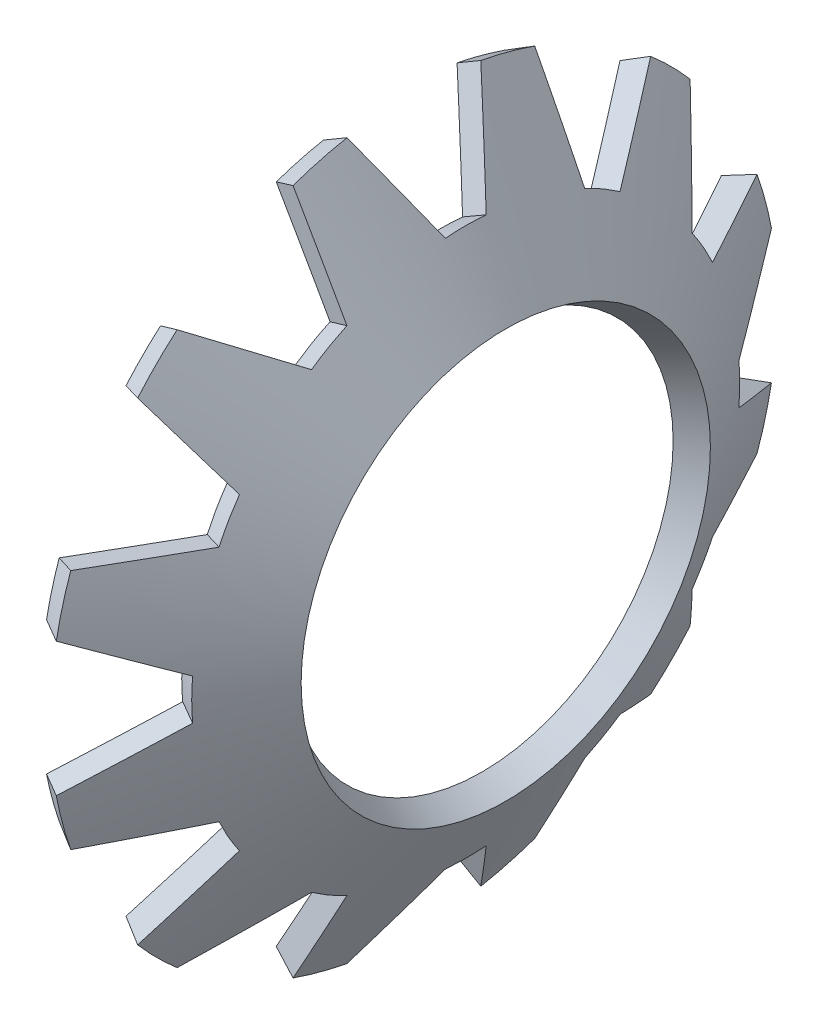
SolidWorks part; units mm, degrees
ref_plane "Plane1" through (0, 0, 0) normal (0, 0, 1) x (1, 0, 0)
ref_plane "Plane2" through (0, 0, 0) normal (0, 1, 0) x (1, 0, 0)
ref_plane "Plane3" through (0, 0, 0) normal (1, 0, 0) x (0, 0, -1)
revolve "Base-Revolve" add sketch "SecSke" angle 360 about L0
sketch "SecSke" plane through (0, 0, 0) normal (0, 0, 1) x (1, 0, 0)
  line L0 (-34.925, 0) -> (9.525, 0) construction
  line L1 (-2.5981, 4.5) -> (-4.6188, 8)
  line L3 (-5.1384, 7.7) -> (-3.1177, 4.2)
  line L4 (-3.1177, 4.2) -> (-2.5981, 4.5)
  line L5 (-5.1384, 7.7) -> (-4.6188, 8)
  dimension "D1" = 60
  dimension "D2" = 4.0415
  dimension "Thickness" = 0.6
  dimension "Inside_dia" = 8.4
  dimension "Outside_dia" = 16
pattern_circular "ExtCuts" count 12 over 360 about axis through (0, 0, 0) along (1, 0, 0)
extrude "ExtCut" cut sketch "ExtCutSke" against normal through all
sketch "ExtCutSke" plane through (-4.6188, 8, 0) normal (0.866, 0.5, 0) x (0, 0, 1)
  line L1 (0, -8.2249) -> (0, 14.0001) construction
  line L2 (0, 0) -> (0, 8) construction
  line L3 (-0.4488, 2.2976) -> (-1.6388, -0.2386)
  line L4 (0.4488, 2.2976) -> (1.6388, -0.2386)
  arc A0 (-0.4488, 2.2976) -> (0.4488, 2.2976) centre (0, 8) ccw
  arc A1 (-1.6388, -0.2386) -> (1.6388, -0.2386) centre (0, 8) ccw
  ellipse E1 centre (0, 6.9282) end of major axis (-8, 6.9282) minor radius 6.9282 construction
  dimension "Clr_dia" = 16.8
  dimension "Cut_dia" = 11.44
  dimension "Cone_side" = 8
  dimension "Cut_ang" = 9
  dimension "Clr_ang" = 22.5
ref_plane "CutPln" through (-4.6188, 8, 0) normal (0.866, 0.5, 0) x (0, 0, 1)
equation "' \"Inside_dia@SecSke\" = 8.4"
equation "' \"Outside_dia@SecSke\" = 16"
equation "' \"Thickness@SecSke\" = 0.6"
equation "' \"Count@ExtCuts\" = 12"
equation "' \"Inside_dia@SecSke\" = 3.2"
equation "' \"Outside_dia@SecSke\" = 6"
equation "' \"Thickness@SecSke\" = 0.4"
equation "' \"Count@ExtCuts\" = 8"
equation " \"Cone_side@ExtCutSke\" = \"Outside_dia@SecSke\" / 2.0"
equation " \"Angle@ExtCuts\" = 360 / \"Count@ExtCuts\""
equation " \"Clr_dia@ExtCutSke\" =  \"Outside_dia@SecSke\" * 1.05"
equation " \"Cut_dia@ExtCutSke\" = \"Outside_dia@SecSke\" - (\"Outside_dia@SecSke\"  - \"Inside_dia@SecSke\" ) * 0.6"
equation " \"Clr_ang@ExtCutSke\" = (360 / \"Count@ExtCuts\") * 0.75"
equation " \"Cut_ang@ExtCutSke\" = (360 / \"Count@ExtCuts\") * 0.3"
